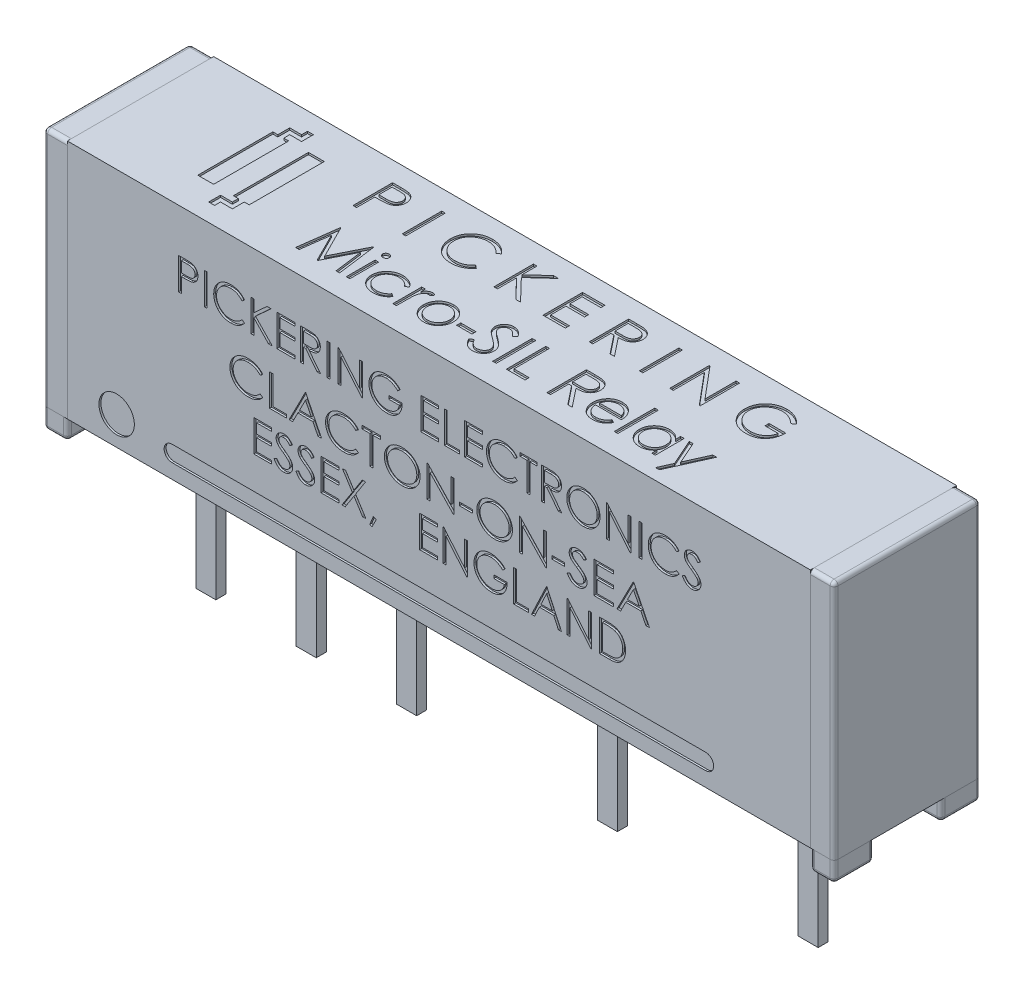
SolidWorks part; units mm, degrees
ref_plane "Front Plane" through (0, 0, 0) normal (0, 0, 1) x (1, 0, 0)
ref_plane "Top Plane" through (0, 0, 0) normal (0, 1, 0) x (1, 0, 0)
ref_plane "Right Plane" through (0, 0, 0) normal (1, 0, 0) x (0, 0, -1)
sketch "Sketch1" plane through (0, 0, 0) normal (0, 1, 0) x (1, 0, 0)
  line L1 (9.4, -1.85) -> (-9.4, -1.85)
  line L2 (9.4, -1.85) -> (9.4, 1.85)
  line L3 (9.4, 1.85) -> (-9.4, 1.85)
  line L4 (-9.4, -1.85) -> (-9.4, 1.85)
  line L5 (9.4, -1.85) -> (-9.4, 1.85) construction
  line L6 (9.4, 1.85) -> (-9.4, -1.85) construction
  point P0 (0, 0)
  dimension "D1" = 3.7
  dimension "D2" = 18.8
extrude "Main Body" add sketch "Sketch1" along normal blind 6.092
sketch "Sketch2" plane through (-9.4, 0, 0) normal (-1, 0, 0) x (0, 0, 1)
  line L1 (-1.85, 6.092) -> (1.85, 6.092)
  line L2 (-1.85, 6.092) -> (-1.85, 0)
  line L3 (-1.85, 0) -> (1.85, 0)
  line L4 (1.85, 6.092) -> (1.85, 0)
extrude "Left Side" add sketch "Sketch2" along normal blind 0.6 separate body
sketch "Sketch3" plane through (9.4, 0, 0) normal (1, 0, 0) x (0, 0, -1)
  line L1 (-1.85, 6.092) -> (1.85, 6.092)
  line L2 (-1.85, 6.092) -> (-1.85, 0)
  line L3 (-1.85, 0) -> (1.85, 0)
  line L4 (1.85, 6.092) -> (1.85, 0)
extrude "Right Side" add sketch "Sketch3" along normal blind 0.6 separate body
sketch "Sketch4" plane through (0, 0, 0) normal (0, -1, 0) x (1, 0, 0)
  line L0 (-9.4, -1.85) -> (-9.4, 1.85) construction
  line L1 (-10, 1.85) -> (-9.4, 1.85)
  line L2 (-10, 1.85) -> (-10, 0.85)
  line L3 (-10, 0.85) -> (-9.4, 0.85)
  line L4 (-9.4, 1.85) -> (-9.4, 0.85)
  line L5 (-9.4, -1.85) -> (-9.4, 1.85) construction
  line L6 (-10, -1.85) -> (-9.4, -1.85)
  line L7 (-10, -1.85) -> (-10, -0.85)
  line L8 (-10, -0.85) -> (-9.4, -0.85)
  line L9 (-9.4, -1.85) -> (-9.4, -0.85)
  line L10 (9.4, 1.85) -> (9.4, -1.85) construction
  line L11 (10, 1.85) -> (9.4, 1.85)
  line L12 (10, 1.85) -> (10, 0.85)
  line L13 (10, 0.85) -> (9.4, 0.85)
  line L14 (9.4, 1.85) -> (9.4, 0.85)
  line L15 (9.4, 1.85) -> (9.4, -1.85) construction
  line L16 (10, -1.85) -> (9.4, -1.85)
  line L17 (10, -1.85) -> (10, -0.85)
  line L18 (10, -0.85) -> (9.4, -0.85)
  line L19 (9.4, -1.85) -> (9.4, -0.85)
  dimension "D1" = 1
  dimension "D2" = 1
  dimension "D3" = 1
  dimension "D4" = 1
extrude "Feet" add sketch "Sketch4" along normal blind 0.508 separate body
sketch "Sketch5" plane through (0, 0, 0) normal (0, -1, 0) x (1, 0, 0)
  line L0 (10, 1.85) -> (10, -1.85) construction
  line L1 (-7.874, -0.127) -> (-7.366, -0.127)
  line L2 (-7.874, -0.127) -> (-7.874, 0.127)
  line L3 (-7.874, 0.127) -> (-7.366, 0.127)
  line L4 (-7.366, -0.127) -> (-7.366, 0.127)
  line L5 (-7.874, -0.127) -> (-7.366, 0.127) construction
  line L6 (-7.874, 0.127) -> (-7.366, -0.127) construction
  line L7 (-2.286, -0.127) -> (-2.794, -0.127)
  line L8 (-2.286, -0.127) -> (-2.286, 0.127)
  line L9 (-2.286, 0.127) -> (-2.794, 0.127)
  line L10 (-2.794, -0.127) -> (-2.794, 0.127)
  line L11 (-2.286, -0.127) -> (-2.794, 0.127) construction
  line L12 (-2.286, 0.127) -> (-2.794, -0.127) construction
  line L13 (2.794, -0.127) -> (2.286, -0.127)
  line L14 (2.794, -0.127) -> (2.794, 0.127)
  line L15 (2.794, 0.127) -> (2.286, 0.127)
  line L16 (2.286, -0.127) -> (2.286, 0.127)
  line L17 (2.794, -0.127) -> (2.286, 0.127) construction
  line L18 (2.794, 0.127) -> (2.286, -0.127) construction
  line L19 (7.366, -0.127) -> (7.874, -0.127)
  line L20 (7.366, -0.127) -> (7.366, 0.127)
  line L21 (7.366, 0.127) -> (7.874, 0.127)
  line L22 (7.874, -0.127) -> (7.874, 0.127)
  line L23 (7.366, -0.127) -> (7.874, 0.127) construction
  line L24 (7.366, 0.127) -> (7.874, -0.127) construction
  line L27 (-4.826, -0.127) -> (-5.334, -0.127)
  line L28 (-4.826, -0.127) -> (-4.826, 0.127)
  line L29 (-4.826, 0.127) -> (-5.334, 0.127)
  line L30 (-5.334, -0.127) -> (-5.334, 0.127)
  line L31 (-4.826, -0.127) -> (-5.334, 0.127) construction
  line L32 (-4.826, 0.127) -> (-5.334, -0.127) construction
  point P0 (-7.62, 0)
  point P5 (-2.54, 0)
  point P10 (2.54, 0)
  point P15 (7.62, 0)
  point P23 (-5.08, 0)
  dimension "D1" = 0.508
  dimension "D2" = 0.254
  dimension "D3" = 0.508
  dimension "D4" = 0.254
  dimension "D5" = 0.508
  dimension "D6" = 0.254
  dimension "D7" = 0.508
  dimension "D8" = 0.254
  dimension "D9" = 5.08
  dimension "D10" = 5.08
  dimension "D11" = 5.08
  dimension "D12" = 2.38
  dimension "D13" = 0.508
  dimension "D14" = 0.254
  dimension "D15" = 2.54
extrude "Pins" add sketch "Sketch5" along normal blind 3.808
sketch "Sketch6"
  dimension "D1" = 10.5
  dimension "D2" = 10.5
  dimension "D3" = 4
  dimension "D4" = 0.45
  dimension "D5" = 3
  dimension "D6" = 1.5
sketch_block_instance "Logo-1"
sketch_block "Logo" parameters "D1"=0.4, "D2"=0.4, "D3"=1.9, "D4"=1.9, "D5"=1.3, "D6"=0.3, "D7"=0.15, "D8"=0.15, "D9"=0.15, "D10"=0.15, "D11"=0.3, "D12"=0.125, "D13"=0.15, "D14"=0.125, "D15"=0.3, "D16"=0.15, "D17"=0.3, "D18"=0.15, "D19"=0.15
extrude "Top side" cut sketch "Sketch6" against normal blind 0.05
sketch "Sketch7"
  dimension "D10" = 0.8963
  dimension "D1" = 13.5
  dimension "D2" = 11
  dimension "D3" = 9.6
  dimension "D4" = 3.25
  dimension "D5" = 4.5
  dimension "D6" = 5.2
  dimension "D7" = 1.9
  dimension "D8" = 1.4
  dimension "D9" = 1.2
extrude "Front Lettering" cut sketch "Sketch7" against normal blind 0.05
sketch "Sketch8"
  dimension "D1" = 11.65
  dimension "D2" = 4.175
  dimension "D3" = 3.5
extrude "Part number" add sketch "Sketch8" along normal blind 0.0001
sketch "Sketch9" plane through (0, 0, -1.85) normal (0, 0, -1) x (-1, 0, 0)
  line L0 (-5.5254, 0.8409) -> (5.9665, 0.8409) construction
  line L1 (-5.5254, 0.9836) -> (5.9665, 0.9836)
  line L2 (-5.5254, 0.6982) -> (5.9665, 0.6982)
  arc A0 (-5.5254, 0.9836) -> (-5.5254, 0.6982) centre (-5.5254, 0.8409) ccw
  arc A1 (5.9665, 0.6982) -> (5.9665, 0.9836) centre (5.9665, 0.8409) ccw
  point P2 (0.2205, 0.8409)
extrude "Extrude9" cut sketch "Sketch9" against normal blind 0.0001
fillet "Fillet1" radius 0.1 5 edges at (10, 3.046, -1.85) (9.7, 6.092, -1.85) (10, 6.092, 0) (9.7, 6.092, 1.85) (10, 3.046, 1.85)
fillet "Fillet2" radius 0.1 5 edges at (-9.7, 6.092, 1.85) (-10, 3.046, 1.85) (-10, 3.046, -1.85) (-9.7, 6.092, -1.85) (-10, 6.092, 0)
fillet "Fillet3" radius 0.1 8 edges at (-9.7, -0.508, 1.85) (-9.4, -0.508, 1.35) (-9.7, -0.508, 0.85) (-10, -0.508, 1.35) (-9.4, -0.254, 1.85) (-9.4, -0.254, 0.85) (-10, -0.254, 0.85) (-10, -0.254, 1.85)
fillet "Fillet4" radius 0.1 8 edges at (-9.7, -0.508, -0.85) (-9.4, -0.508, -1.35) (-9.7, -0.508, -1.85) (-10, -0.508, -1.35) (-10, -0.254, -1.85) (-9.4, -0.254, -1.85) (-9.4, -0.254, -0.85) (-10, -0.254, -0.85)
fillet "Fillet5" radius 0.1 8 edges at (9.7, -0.508, -1.85) (9.4, -0.508, -1.35) (9.7, -0.508, -0.85) (10, -0.508, -1.35) (9.4, -0.254, -0.85) (10, -0.254, -0.85) (9.4, -0.254, -1.85) (10, -0.254, -1.85)
fillet "Fillet6" radius 0.1 8 edges at (9.7, -0.508, 0.85) (9.4, -0.508, 1.35) (9.7, -0.508, 1.85) (10, -0.508, 1.35) (9.4, -0.254, 0.85) (10, -0.254, 0.85) (10, -0.254, 1.85) (9.4, -0.254, 1.85)
